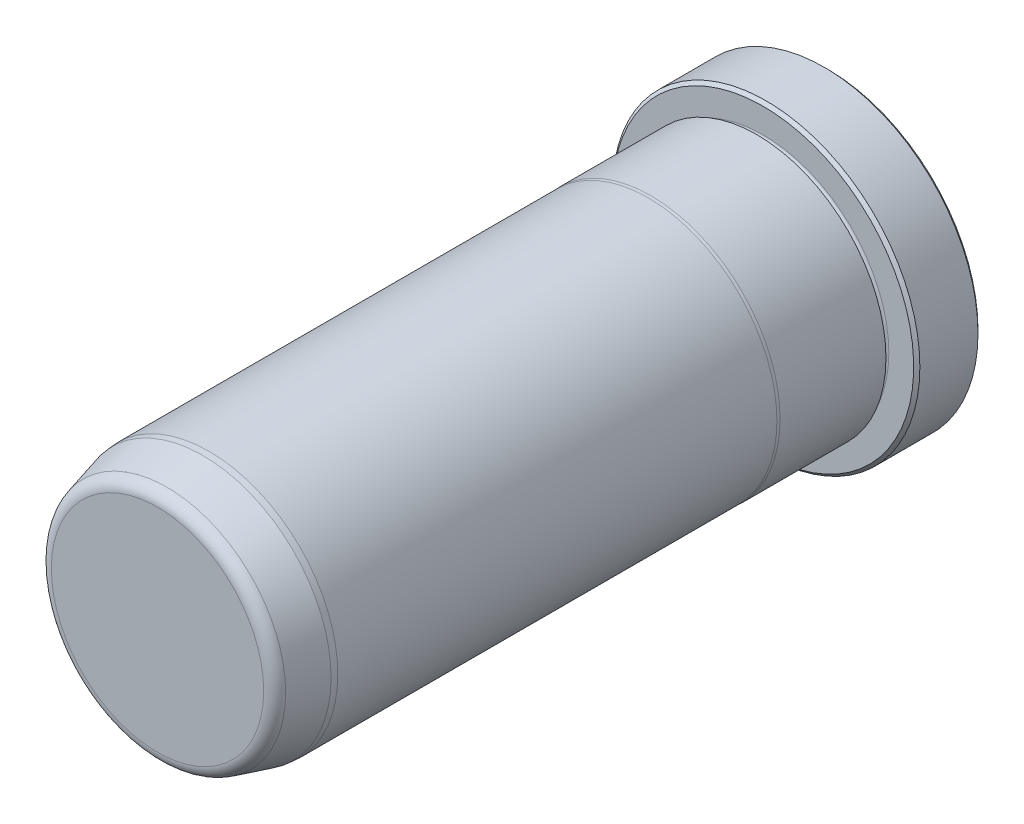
SolidWorks part; units mm, degrees
ref_plane "Front Plane" through (0, 0, 0) normal (0, 0, 1) x (1, 0, 0)
ref_plane "Top Plane" through (0, 0, 0) normal (0, 1, 0) x (1, 0, 0)
ref_plane "Right Plane" through (0, 0, 0) normal (1, 0, 0) x (0, 0, -1)
sketch "Sketch1" plane through (0, 0, 0) normal (1, 0, 0) x (0, 0, -1)
  line L0 (0, 0) -> (0, 18.923)
  line L1 (0, 18.923) -> (-7.9248, 18.923)
  line L2 (-7.9248, 18.923) -> (-7.9248, 15.4813)
  line L3 (-4.7498, 15.1003) -> (-5.5118, 15.1003) construction
  line L4 (-8.6868, 15.4813) -> (-8.6868, 15.8877)
  line L5 (-8.6868, 15.8877) -> (-21.7348, 15.8877)
  line L6 (-21.7348, 15.8877) -> (-22.098, 15.8623)
  line L7 (-22.098, 15.8623) -> (-76.2, 15.8623)
  line L9 (-82.55, 14.2983) -> (-82.55, 0)
  line L10 (-82.55, 0) -> (0, 0)
  line L11 (0, 0) -> (13.6287, 0) construction
  line L12 (-76.2, 15.8623) -> (-76.962, 15.7956)
  line L13 (-76.962, 15.7956) -> (-82.55, 14.2983)
  arc A0 (-8.6868, 15.4813) -> (-7.9248, 15.4813) centre (-8.3058, 15.4813) ccw
  dimension "D14" = 0.762
  dimension "D1" = 7.9248
  dimension "D2" = 0.762
  dimension "D3" = 37.846
  dimension "D4" = 31.7754
  dimension "D5" = 22.098
  dimension "D6" = 82.55
  dimension "D7" = 0.7874
  dimension "D8" = 4
  dimension "D9" = 31.7246
  dimension "D10" = 5
  dimension "D11" = 15
  dimension "D12" = 0.762
  dimension "D13" = 6.35
revolve "Revolve1" add sketch "Sketch1" angle 360 about L11
fillet "Fillet6" radius 1.5875 1 edges at (14.2983, 0, 82.55)
chamfer "Chamfer1" distance 0.381 angle 45 2 edges at (18.923, 0, 0) (18.923, 0, 7.9248)
